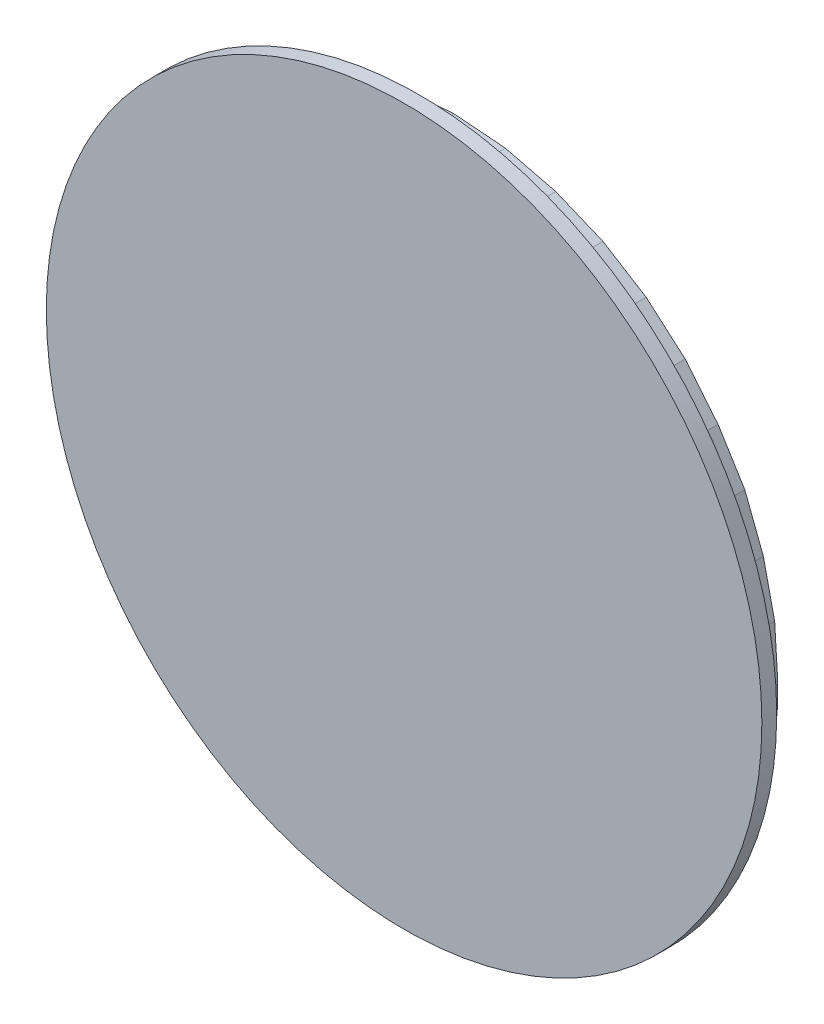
SolidWorks part; units mm, degrees
ref_plane "前视基准面" through (0, 0, 0) normal (0, 0, 1) x (1, 0, 0)
ref_plane "上视基准面" through (0, 0, 0) normal (0, 1, 0) x (1, 0, 0)
ref_plane "右视基准面" through (0, 0, 0) normal (1, 0, 0) x (0, 0, -1)
other "Configuration Table"
sketch "Cover_OD53_total_top13_9_Sketch" plane through (0, 0, 0) normal (0, 0, 1) x (1, 0, 0)
  circle A0 centre (0, 0) radius 26.5
extrude "Cover_OD53_total_top13_9" add sketch "Cover_OD53_total_top13_9_Sketch" along normal blind 1.1 from offset 12.8
sketch "LCD_rear_reference_Sketch" plane through (0, 0, 0) normal (0, 0, 1) x (1, 0, 0)
  line L0 (5.1007, -25.8897) -> (-5.1007, -25.8897)
  line L1 (-5.1007, -25.8897) -> (-7.9191, -24.9758)
  line L2 (-7.9191, -24.9758) -> (-9.2148, -24.2138)
  line L3 (-9.2148, -24.2138) -> (-9.2148, -22.7639)
  line L4 (-9.2148, -22.7639) -> (-11.3459, -22.7639)
  line L5 (-11.3459, -22.7639) -> (-13.4802, -21.1622)
  line L6 (-13.4802, -21.1622) -> (-16.5255, -18.4949)
  line L7 (-16.5255, -18.4949) -> (-19.038, -15.3659)
  line L8 (-19.038, -15.3659) -> (-21.1691, -11.9365)
  line L9 (-21.1691, -11.9365) -> (-22.6917, -8.1972)
  line L10 (-22.6917, -8.1972) -> (-23.7605, -4.3093)
  line L11 (-23.7605, -4.3093) -> (-23.9875, -1.9455)
  line L12 (-23.9875, -1.9455) -> (-23.9875, -0.4214)
  line L13 (-23.9875, -0.4214) -> (-23.7573, 3.3147)
  line L14 (-23.7573, 3.3147) -> (-22.9219, 7.0541)
  line L15 (-22.9219, 7.0541) -> (-21.4749, 10.6384)
  line L16 (-21.4749, 10.6384) -> (-19.5708, 13.8385)
  line L17 (-19.5708, 13.8385) -> (-17.1339, 16.8126)
  line L18 (-17.1339, 16.8126) -> (-14.2399, 19.3313)
  line L19 (-14.2399, 19.3313) -> (-10.9644, 21.314)
  line L20 (-10.9644, 21.314) -> (-7.462, 22.7606)
  line L21 (-7.462, 22.7606) -> (-3.805, 23.6777)
  line L22 (-3.805, 23.6777) -> (0, 23.9813)
  line L23 (0, 23.9813) -> (3.8083, 23.6777)
  line L24 (3.8083, 23.6777) -> (7.5409, 22.7606)
  line L25 (7.5409, 22.7606) -> (11.0433, 21.314)
  line L26 (11.0433, 21.314) -> (14.2399, 19.3313)
  line L27 (14.2399, 19.3313) -> (17.1339, 16.8126)
  line L28 (17.1339, 16.8126) -> (19.5708, 13.8385)
  line L29 (19.5708, 13.8385) -> (21.5506, 10.6384)
  line L30 (21.5506, 10.6384) -> (22.9219, 7.0541)
  line L31 (22.9219, 7.0541) -> (23.7605, 3.3147)
  line L32 (23.7605, 3.3147) -> (23.9875, -0.4214)
  line L33 (23.9875, -0.4214) -> (23.9875, -1.9455)
  line L34 (23.9875, -1.9455) -> (23.7605, -4.3093)
  line L35 (23.7605, -4.3093) -> (22.7707, -8.1972)
  line L36 (22.7707, -8.1972) -> (21.1691, -11.9365)
  line L37 (21.1691, -11.9365) -> (19.1137, -15.3659)
  line L38 (19.1137, -15.3659) -> (16.5255, -18.4949)
  line L39 (16.5255, -18.4949) -> (13.5558, -21.1622)
  line L40 (13.5558, -21.1622) -> (11.4215, -22.7639)
  line L41 (11.4215, -22.7639) -> (9.2905, -22.7639)
  line L42 (9.2905, -22.7639) -> (9.2905, -24.2138)
  line L43 (9.2905, -24.2138) -> (7.9191, -24.9758)
  line L44 (7.9191, -24.9758) -> (5.1007, -25.8897)
extrude "LCD_rear_reference" add sketch "LCD_rear_reference_Sketch" along normal blind 2.585 from offset 10.215
